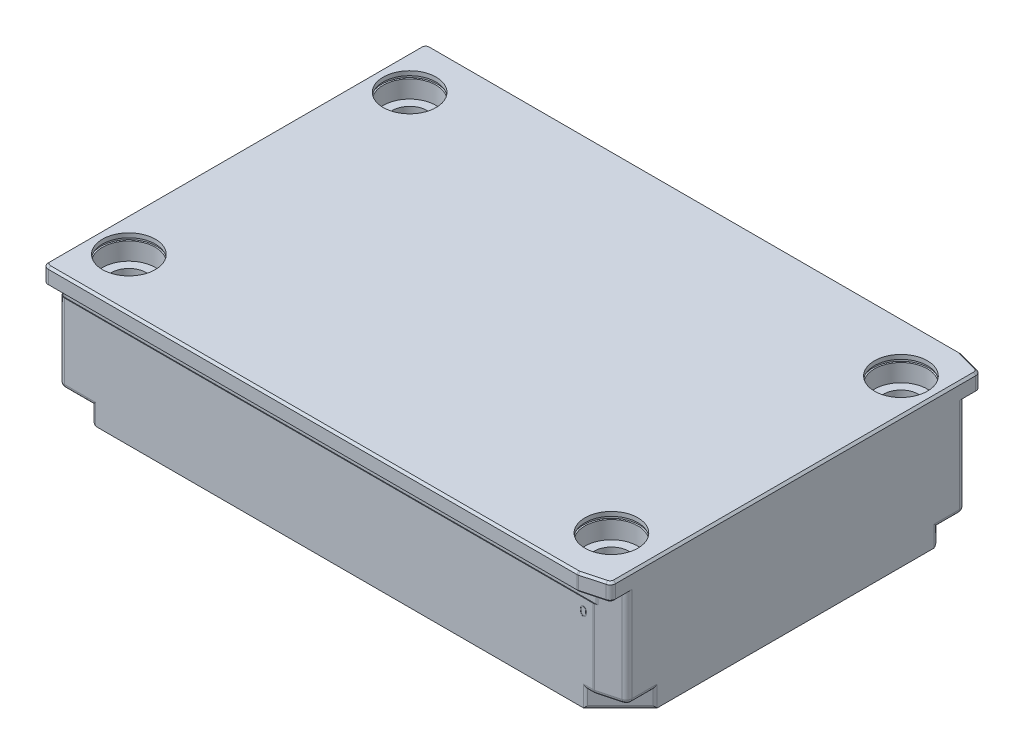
SolidWorks part; units mm, degrees
ref_plane "Front Plane" through (0, 0, 0) normal (0, 0, 1) x (1, 0, 0)
ref_plane "Top Plane" through (0, 0, 0) normal (0, 1, 0) x (1, 0, 0)
ref_plane "Right Plane" through (0, 0, 0) normal (1, 0, 0) x (0, 0, -1)
sketch "Sketch1" plane through (0, 0, 0) normal (0, 1, 0) x (1, 0, 0)
  line L0 (-101.6, -69.2912) -> (101.6, 69.2912) construction
  line L1 (-101.6, 69.2912) -> (101.6, 69.2912)
  line L2 (-101.6, 69.2912) -> (-101.6, -69.2912)
  line L3 (-101.6, -69.2912) -> (101.6, -69.2912)
  line L4 (101.6, 69.2912) -> (101.6, -69.2912)
  dimension "D1" = 138.5824
  dimension "D2" = 203.2
extrude "Boss-Extrude1" add sketch "Sketch1" along normal blind 47.625
sketch "Sketch2" plane through (101.6, 0, 0) normal (1, 0, 0) x (0, 0, -1)
  line L0 (-69.2912, 47.625) -> (-69.2912, 0) construction
  line L1 (-69.2912, 0) -> (-63.4492, 0)
  line L2 (-69.2912, 0) -> (-69.2912, 41.3004)
  line L3 (-69.2912, 41.3004) -> (-63.4492, 41.3004)
  line L4 (-63.4492, 0) -> (-63.4492, 41.3004)
  line L5 (-69.2912, 0) -> (69.2912, 0) construction
  line L6 (-69.2912, 47.625) -> (69.2912, 47.625) construction
  line L7 (69.2912, 0) -> (63.4492, 0)
  line L8 (69.2912, 0) -> (69.2912, 41.3004)
  line L9 (69.2912, 41.3004) -> (63.4492, 41.3004)
  line L10 (63.4492, 0) -> (63.4492, 41.3004)
  dimension "D1" = 5.842
  dimension "D2" = 6.3246
extrude "Cut-Extrude1" cut sketch "Sketch2" against normal through all
hole_wizard "Hole1" positions "Sketch4" profile "Sketch3" legacy
sketch "Sketch4" plane through (0, 47.625, 0) normal (0, 1, 0) x (1, 0, 0)
  point P0 (-88.9, 50.8)
  point P2 (88.9, 50.8)
  point P4 (85.725, -50.8)
  point P6 (-88.9, -50.8)
  dimension "D1" = 85.725
  dimension "D2" = 177.8
  dimension "D3" = 88.9
  dimension "D4" = 50.8
  dimension "D5" = 101.6
sketch "Sketch3" plane through (-88.9, 47.625, -50.8) normal (1, 0, 0) x (0, 0, 1)
  line L0 (0, 0) -> (0, 47.625)
  line L1 (0, 47.625) -> (6.35, 47.625)
  line L2 (6.35, 47.625) -> (6.35, 8.89)
  line L3 (6.35, 8.89) -> (9.5631, 8.89)
  line L4 (9.5631, 8.89) -> (9.5631, 0)
  line L5 (9.5631, 0) -> (0, 0)
  line L6 (0, 110) -> (0, -10) construction
  dimension "Diameter" = 12.7
  dimension "Depth" = 47.625
  dimension "C-Bore Diameter" = 19.1262
  dimension "C-Bore Depth" = 8.89
ref_plane "Plane1" through (0, 45.085, 0) normal (0, 1, 0) x (1, 0, 0)
hole_wizard "Hole2" positions "Sketch6" profile "Sketch5" legacy
sketch "Sketch6" plane through (0, 45.085, 0) normal (0, 1, 0) x (1, 0, 0)
  point P0 (-88.9, 50.8)
  point P3 (-88.9, -50.8)
  point P6 (85.725, -50.8)
  point P9 (88.9, 50.8)
sketch "Sketch5" plane through (-88.9, 45.085, -50.8) normal (1, 0, 0) x (0, 0, -1)
  line L0 (0, 0) -> (0, 0.9906)
  line L1 (0, 0.9906) -> (10.1092, 0.9906)
  line L2 (10.1092, 0.9906) -> (10.1092, 0)
  line L3 (10.1092, 0) -> (0, 0)
  line L4 (0, 110) -> (0, -10) construction
  dimension "Diameter" = 20.2184
  dimension "Depth" = 0.9906
sketch "Sketch9" plane through (0, 0, 0) normal (0, -1, 0) x (1, 0, 0)
  line L0 (-101.6, 63.4492) -> (-101.6, 50.7492)
  line L1 (-101.6, -63.4492) -> (-101.6, 63.4492) construction
  line L2 (-101.6, 50.7492) -> (-88.9, 63.4492)
  line L3 (-101.6, 63.4492) -> (101.6, 63.4492) construction
  line L4 (-88.9, 63.4492) -> (-101.6, 63.4492)
  line L5 (88.9, 63.4492) -> (101.6, 63.4492)
  line L6 (-101.6, 63.4492) -> (101.6, 63.4492) construction
  line L7 (101.6, 63.4492) -> (101.6, 50.7492)
  line L8 (101.6, 63.4492) -> (101.6, -63.4492) construction
  line L9 (101.6, 50.7492) -> (88.9, 63.4492)
  line L10 (101.6, -50.7492) -> (101.6, -63.4492)
  line L11 (101.6, -63.4492) -> (88.9, -63.4492)
  line L12 (-101.6, -63.4492) -> (101.6, -63.4492) construction
  line L13 (88.9, -63.4492) -> (101.6, -50.7492)
  line L14 (-88.9, -63.4492) -> (-101.6, -63.4492)
  line L15 (-101.6, -63.4492) -> (101.6, -63.4492) construction
  line L16 (-101.6, -63.4492) -> (-101.6, -50.7492)
  line L17 (-101.6, -50.7492) -> (-88.9, -63.4492)
  dimension "D1" = 12.7
extrude "Cut-Extrude2" cut sketch "Sketch9" against normal blind 6.35
chamfer "Chamfer1" distance 9.652 angle 15 4 edges at (101.6, 44.4627, -69.2912) (101.6, 23.8252, -63.4492) (101.6, 23.8252, 63.4492) (101.6, 44.4627, 69.2912)
sketch "Sketch10" plane through (101.6, 0, 0) normal (1, 0, 0) x (0, 0, -1)
  line L0 (66.705, 41.3004) -> (60.863, 41.3004) construction
  line L1 (-63.4492, 41.3004) -> (-63.1952, 41.3004)
  line L2 (-63.4492, 41.3004) -> (-63.4492, 34.9504)
  line L3 (-63.4492, 34.9504) -> (-63.1952, 34.9504)
  line L4 (-63.1952, 41.3004) -> (-63.1952, 34.9504)
  line L5 (63.4492, 41.3004) -> (63.1952, 41.3004)
  line L6 (63.4492, 41.3004) -> (63.4492, 34.9504)
  line L7 (63.4492, 34.9504) -> (63.1952, 34.9504)
  line L8 (63.1952, 41.3004) -> (63.1952, 34.9504)
  line L9 (63.4492, 41.3004) -> (63.4492, 6.35) construction
  line L10 (-60.863, 41.3004) -> (-66.705, 41.3004) construction
  line L11 (-63.4492, 6.35) -> (-63.4492, 41.3004) construction
  dimension "D1" = 0.254
  dimension "D2" = 6.35
extrude "Cut-Extrude3" cut sketch "Sketch10" against normal through all
hole_wizard "1/4-20 Tapped Hole1" positions "Sketch11" profile "Sketch12" tap size "1/4-20" standard "ANSI Inch"
sketch "Sketch11" plane through (-101.6, 0, 0) normal (-1, 0, 0) x (0, 0, 1)
  line L0 (-69.2912, 47.625) -> (69.2912, 47.625) construction
  point P0 (0, 37.465)
  dimension "D1" = 10.16
sketch "Sketch12" plane through (-101.6, 37.465, 0) normal (0, 1, 0) x (0, 0, 1)
  line L0 (0, 0) -> (0, 13.4718)
  line L1 (0, 13.4718) -> (2.5527, 11.938)
  line L2 (2.5527, 11.938) -> (2.5527, 0)
  line L5 (2.5527, 0) -> (0, 0)
  line L10 (0, 13.4718) -> (-2.5527, 11.938) construction
  line L11 (0, -6.35) -> (0, 107.95) construction
  dimension "Tap Drill Dia." = 5.1054
  dimension "Tap Drill Depth" = 11.938
  dimension "Drill Angle" = 118
fillet "Fillet1" radius 2.032 12 edges at (-101.6, 38.1254, 63.1952) (-101.6, 44.4627, 69.2912) (-101.6, 38.1254, -63.1952) (-101.6, 44.4627, -69.2912) (101.6, 23.8252, -60.863) (92.8959, 38.1254, -63.1952) (91.948, 44.4627, -69.2912) (101.6, 44.4627, -66.705) (101.6, 23.8252, 60.863) (92.8959, 38.1254, 63.1952) (101.6, 44.4627, 66.705) (91.948, 44.4627, 69.2912)
fillet "Fillet2" radius 2.032 4 edges at (-101.6, 20.6502, -63.4492) (91.948, 20.6502, -63.4492) (91.948, 20.6502, 63.4492) (-101.6, 20.6502, 63.4492)
fillet "Fillet3" radius 1.524 28 edges at (95.25, 0, -57.0992) (101.6, 3.175, -50.7492) (101.6, 6.35, -55.0265) (101.1801, 6.35, -60.5407) (96.1502, 6.35, -62.3232) (91.9457, 6.35, -63.4318) (90.2902, 6.35, -63.4492) (88.9, 3.175, -63.4492) (101.6, 3.175, 50.7492) (95.25, 0, 57.0992) (88.9, 3.175, 63.4492) (90.2902, 6.35, 63.4492) (91.9457, 6.35, 63.4318) (96.1502, 6.35, 62.3232) (101.1801, 6.35, 60.5407) (101.6, 6.35, 55.0265) (-95.25, 0, 57.0992) (-101.6, 3.175, 50.7492) (-101.6, 6.35, 56.0832) (-101.0048, 6.35, 62.854) (-94.234, 6.35, 63.4492) (-88.9, 3.175, 63.4492) (-101.6, 3.175, -50.7492) (-95.25, 0, -57.0992) (-88.9, 3.175, -63.4492) (-94.234, 6.35, -63.4492) (-101.0048, 6.35, -62.854) (-101.6, 6.35, -56.0832)
chamfer "Chamfer4" distance 0.762 angle 45 1 edges at (-101.6, 37.465, 2.5527)
chamfer "Chamfer2" distance 0.762 angle 45 26 edges at (-101.6, 41.3004, -64.2112) (-3.9438, 41.3004, -69.2912) (101.6, 41.3004, -62.2247) (101.6, 41.3004, 62.2247) (-101.6, 41.3004, 64.2112) (-3.9438, 41.3004, 69.2912) (101.6, 47.625, 0) (-3.9438, 47.625, -69.2912) (-101.6, 47.625, 0) (-3.9438, 47.625, 69.2912) (-101.0048, 41.3004, -68.696) (91.9457, 41.3004, -69.2738) (96.1502, 41.3004, -68.1652) (101.1801, 41.3004, -66.3827) (101.1801, 41.3004, 66.3827) (96.1502, 41.3004, 68.1652) (-101.0048, 41.3004, 68.696) (91.9457, 41.3004, 69.2738) (96.1502, 47.625, -68.1652) (91.9457, 47.625, -69.2738) (101.1801, 47.625, -66.3827) (-101.0048, 47.625, -68.696) (101.1801, 47.625, 66.3827) (96.1502, 47.625, 68.1652) (-101.0048, 47.625, 68.696) (91.9457, 47.625, 69.2738)
chamfer "Chamfer3" distance 0.381 angle 45 4 edges at (-101.6, 0, 0) (0, 0, -63.4492) (101.6, 0, 0) (0, 0, 63.4492)
sketch "Sketch13" plane through (0, 0, 63.4492) normal (0, 0, 1) x (1, 0, 0)
  text T0 "0"
extrude "Cut-Extrude4" cut sketch "Sketch13" against normal blind 0.0508
